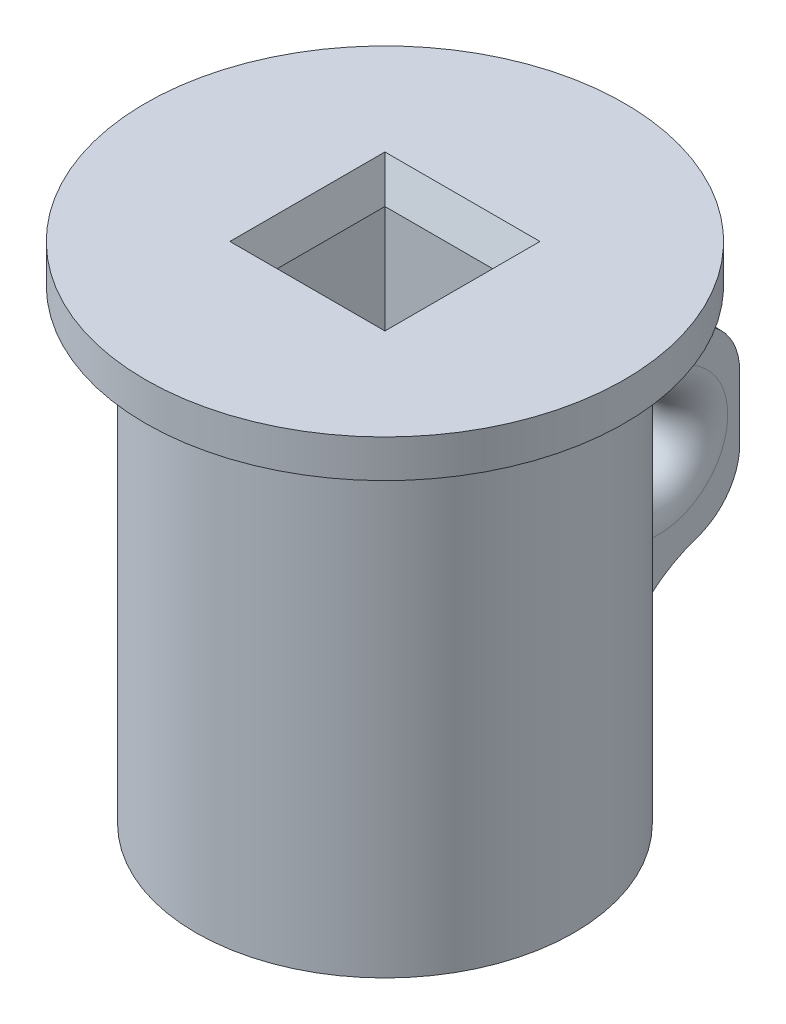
SolidWorks part; units mm, degrees
ref_plane "Спереди" through (0, 0, 0) normal (0, 0, 1) x (1, 0, 0)
ref_plane "Сверху" through (0, 0, 0) normal (0, 1, 0) x (1, 0, 0)
ref_plane "Справа" through (0, 0, 0) normal (1, 0, 0) x (0, 0, -1)
sketch "Эскиз1" plane through (0, 0, 0) normal (0, 1, 0) x (1, 0, 0)
  line L1 (5.15, -5.15) -> (-5.15, -5.15)
  line L2 (5.15, -5.15) -> (5.15, 5.15)
  line L3 (5.15, 5.15) -> (-5.15, 5.15)
  line L4 (-5.15, -5.15) -> (-5.15, 5.15)
  line L5 (5.15, -5.15) -> (-5.15, 5.15) construction
  line L6 (5.15, 5.15) -> (-5.15, -5.15) construction
  circle A0 centre (0, 0) radius 15
  dimension "D1" = 30
  dimension "D2" = 10.3
extrude "Бобышка-Вытянуть1" add sketch "Эскиз1" along normal blind 40
sketch "Sketch1" plane through (0, 40, 0) normal (0, 1, 0) x (1, 0, 0)
  line L1 (5.15, -5.15) -> (-5.15, -5.15)
  line L2 (5.15, -5.15) -> (5.15, 5.15)
  line L3 (5.15, 5.15) -> (-5.15, 5.15)
  line L4 (-5.15, -5.15) -> (-5.15, 5.15)
  line L5 (5.15, -5.15) -> (-5.15, 5.15) construction
  line L6 (5.15, 5.15) -> (-5.15, -5.15) construction
  circle A0 centre (0, 0) radius 19
  dimension "D1" = 38
extrude "Boss-Extrude1" add sketch "Sketch1" against normal blind 3
sketch "Sketch6" plane through (0, 0, -5.15) normal (0, 0, 1) x (1, 0, 0)
  line L0 (0, 0) -> (0, 79.7395) construction
  line L1 (5.15, 0) -> (-5.15, 0) construction
  line L3 (-3, 25) -> (3, 25)
  line L4 (-3, 25) -> (-3, 10)
  line L5 (-3, 10) -> (3, 10)
  line L6 (3, 25) -> (3, 10)
  line L7 (-3, 25) -> (3, 10) construction
  line L8 (-3, 10) -> (3, 25) construction
  point P4 (0, 17.5)
  dimension "D1" = 6
  dimension "D2" = 15
  dimension "D3" = 10
extrude "Boss-Extrude3" add sketch "Sketch6" against normal blind 20
fillet "Fillet1" radius 5 2 edges at (0, 10, -25.15) (0, 25, -25.15)
sketch "Sketch7" plane through (3, 0, 0) normal (1, 0, 0) x (0, 0, -1)
  line L0 (18.6969, 25) -> (18.6969, 10) construction
  line L1 (20.15, 25) -> (14.6969, 25) construction
  line L2 (20.15, 10) -> (14.6969, 10) construction
  line L3 (14.6969, 10) -> (14.6969, 25) construction
  circle A0 centre (18.6969, 17.5) radius 2.5
  dimension "D1" = 5
  dimension "D2" = 4
extrude "Cut-Extrude3" cut sketch "Sketch7" against normal through all
fillet "Fillet2" radius 10 2 edges at (0, 25, -15) (0, 10, -15)
sketch "Sketch8" plane through (3, 0, 0) normal (1, 0, 0) x (0, 0, -1)
  line L0 (14.6969, 0.6431) -> (14.6969, 34.3569) construction
  line L1 (16.6969, 15.6431) -> (14.6969, 15.6431)
  line L2 (16.6969, 15.6431) -> (16.6969, 35.6431)
  line L3 (16.6969, 35.6431) -> (14.6969, 35.6431)
  line L4 (14.6969, 15.6431) -> (14.6969, 35.6431)
  line L5 (16.6969, 15.6431) -> (14.6969, 35.6431) construction
  line L6 (16.6969, 35.6431) -> (14.6969, 15.6431) construction
  point P0 (15.6969, 25.6431)
  dimension "D1" = 2
  dimension "D2" = 15
  dimension "D3" = 20
extrude "Cut-Extrude4" cut sketch "Sketch8" against normal through all
fillet "Fillet3" radius 3 2 edges at (-3, 17.5, -21.1969) (3, 17.5, -21.1969)
fillet "Fillet4" radius 1 2 edges at (-1.9351, 15.6431, -16.0816) (2.248, 15.6431, -15.7143)
fillet "Fillet5" radius 1 1 edges at (0, 15.6431, -14.6969)
chamfer "Chamfer1" distance 1 angle 70 4 edges at (5.15, 40, 0) (0, 40, 5.15) (-5.15, 40, 0) (0, 40, -5.15)
